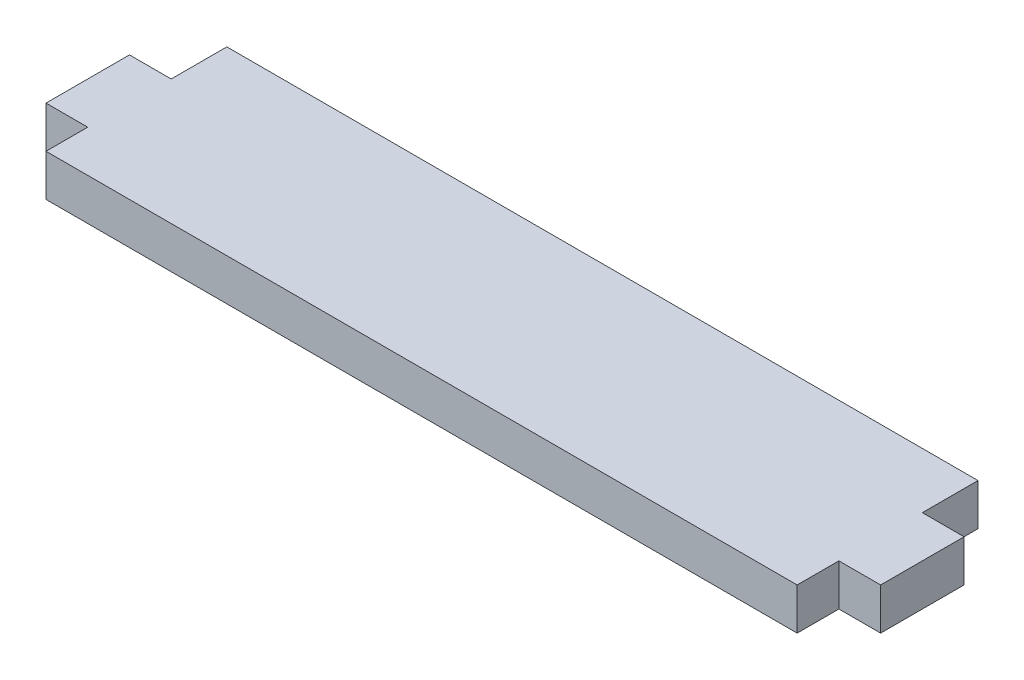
SolidWorks part; units mm, degrees
ref_plane "Front Plane" through (0, 0, 0) normal (0, 0, 1) x (1, 0, 0)
ref_plane "Top Plane" through (0, 0, 0) normal (0, 1, 0) x (1, 0, 0)
ref_plane "Right Plane" through (0, 0, 0) normal (1, 0, 0) x (0, 0, -1)
sketch "Sketch1" plane through (0, 0, 0) normal (0, 1, 0) x (1, 0, 0)
  line L1 (-27, 6.5) -> (27, 6.5)
  line L2 (-27, 6.5) -> (-27, -6.5)
  line L3 (-27, -6.5) -> (27, -6.5)
  line L4 (27, 6.5) -> (27, -6.5)
  line L5 (-27, 6.5) -> (27, -6.5) construction
  line L6 (-27, -6.5) -> (27, 6.5) construction
  point P0 (0, 0)
  dimension "D1" = 13
  dimension "D2" = 54
extrude "Boss-Extrude1" add sketch "Sketch1" along normal blind 3
sketch "Sketch2" plane through (0, 0, 0) normal (0, 1, 0) x (1, 0, 0)
  line L0 (27, 6.5) -> (-27, 6.5) construction
  line L1 (-27, 6.5) -> (-27, -6.5) construction
  line L2 (0, 0) -> (0, 6.5926) construction
  line L3 (30, -3.5) -> (27, 2.5) construction
  line L4 (-30, 2.5) -> (-27, 2.5)
  line L5 (-30, 2.5) -> (-30, -3.5)
  line L6 (-30, -3.5) -> (-27, -3.5)
  line L7 (-27, 2.5) -> (-27, -3.5)
  line L8 (-30, 2.5) -> (-27, -3.5) construction
  line L9 (-30, -3.5) -> (-27, 2.5) construction
  line L10 (30, 2.5) -> (27, -3.5) construction
  line L11 (30, 0) -> (31.5, 0) construction
  line L12 (27, 2.5) -> (27, -3.5)
  line L13 (30, -3.5) -> (27, -3.5)
  line L14 (30, 2.5) -> (30, -3.5)
  line L15 (30, 2.5) -> (27, 2.5)
  dimension "D1" = 3
  dimension "D2" = 6
  dimension "D3" = 4
extrude "Boss-Extrude2" add sketch "Sketch2" along normal blind 3
